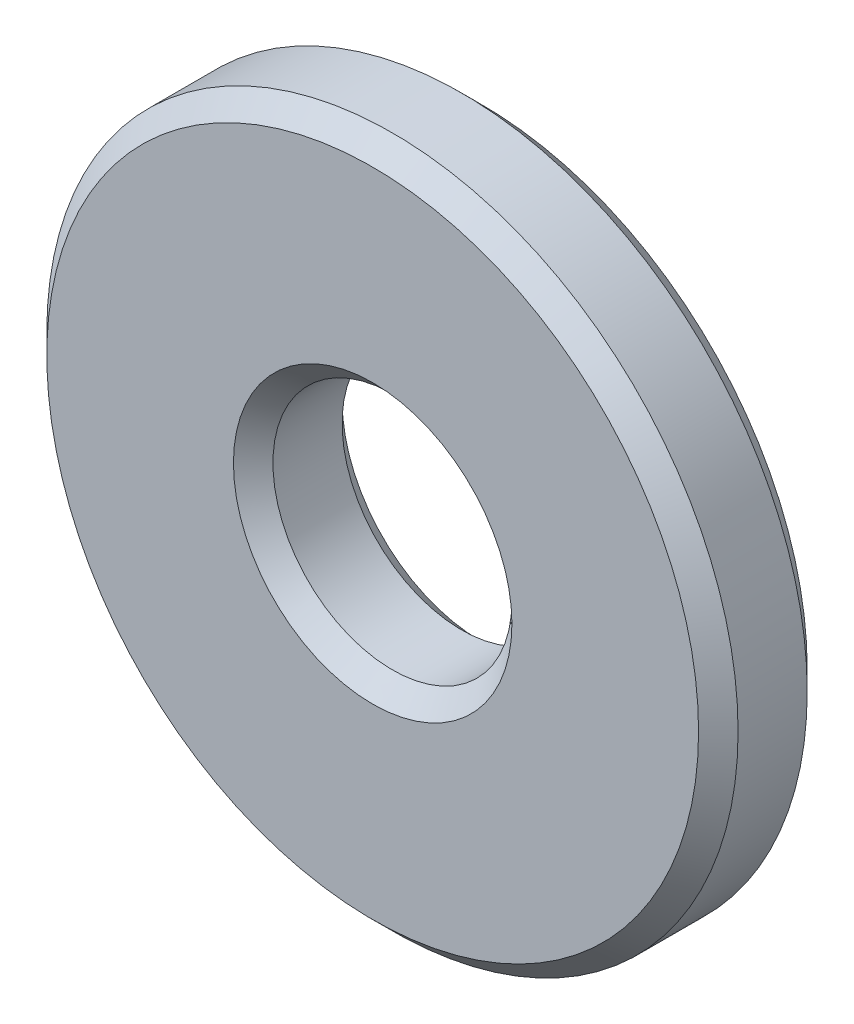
SolidWorks part; units mm, degrees
ref_plane "Plan1" through (0, 0, 0) normal (0, 0, 1) x (1, 0, 0)
ref_plane "Plan2" through (0, 0, 0) normal (0, 1, 0) x (1, 0, 0)
ref_plane "Plan3" through (0, 0, 0) normal (1, 0, 0) x (0, 0, -1)
sketch "Esquisse1" plane through (0, 0, 0) normal (0, 0, 1) x (1, 0, 0)
  circle A0 centre (0, 0) radius 17.5
  circle A1 centre (0, 0) radius 6.05
  dimension "D1" = 35
  dimension "D2" = 12.1
extrude "Base-Extrusion" add sketch "Esquisse1" along normal blind 5.5
chamfer "Chanfrein1" distance 1 angle 45
